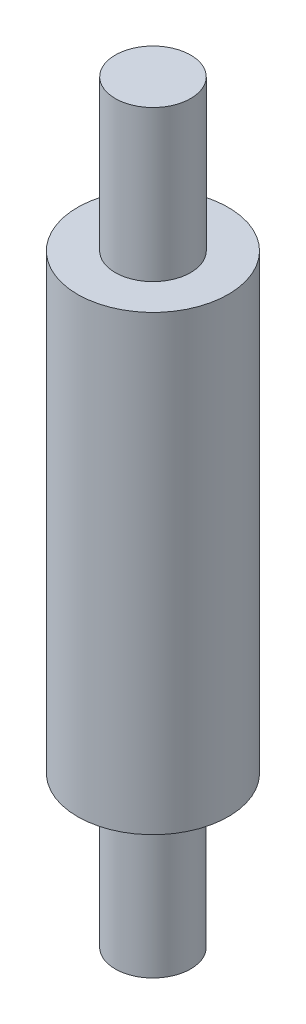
SolidWorks part; units mm, degrees
ref_plane "Front" through (0, 0, 0) normal (0, 0, 1) x (1, 0, 0)
ref_plane "Top" through (0, 0, 0) normal (0, 1, 0) x (1, 0, 0)
ref_plane "Right" through (0, 0, 0) normal (1, 0, 0) x (0, 0, -1)
sketch "Sketch1" plane through (0, 0, 0) normal (0, 1, 0) x (1, 0, 0)
  circle A0 centre (0, 0) radius 3
extrude "Extrude1" add sketch "Sketch1" along normal blind 18
sketch "Sketch2" plane through (0, 18, 0) normal (0, 1, 0) x (-1, 0, 0)
  circle A0 centre (0, 0) radius 1.5
extrude "Extrude2" add sketch "Sketch2" along normal blind 6
sketch "Sketch3" plane through (0, 0, 0) normal (0, -1, 0) x (1, 0, 0)
  circle A0 centre (0, 0) radius 1.5
extrude "Extrude3" add sketch "Sketch3" along normal blind 6
